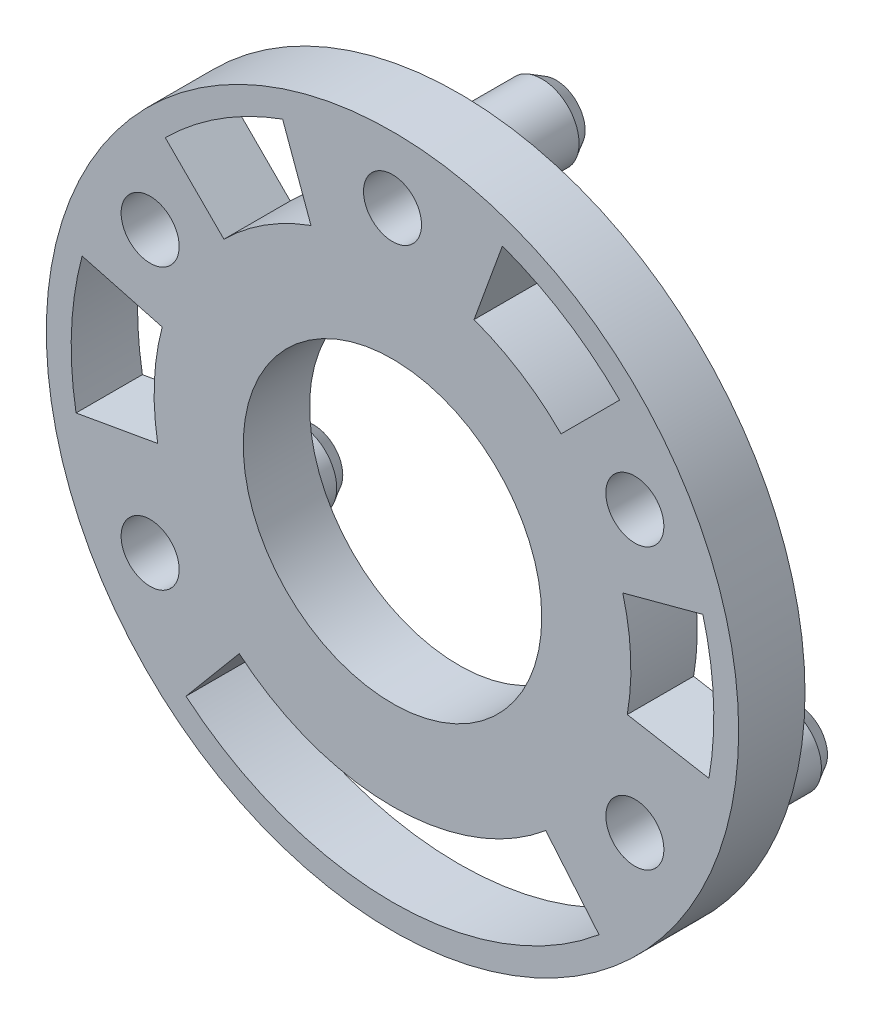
SolidWorks part; units mm, degrees
ref_plane "Front Plane" through (0, 0, 0) normal (0, 0, 1) x (1, 0, 0)
ref_plane "Top Plane" through (0, 0, 0) normal (0, 1, 0) x (1, 0, 0)
ref_plane "Right Plane" through (0, 0, 0) normal (1, 0, 0) x (0, 0, -1)
sketch "Sketch1" plane through (0, 0, 0) normal (0, 0, 1) x (1, 0, 0)
  line L0 (0, 0) -> (14.6142, -8.4375) construction
  line L1 (0, 0) -> (-14.6142, -8.4375) construction
  line L2 (0, -55) -> (0, 55) construction
  line L3 (-6.6266, 18.2065) -> (0, 0) construction
  line L4 (0, 0) -> (-19.0807, -3.3644) construction
  line L6 (-14.1566, -2.4962) -> (-19.0807, -3.3644)
  line L7 (-6.6266, 18.2065) -> (-4.9165, 13.5081)
  line L8 (19.0807, -3.3644) -> (14.1566, -2.4962)
  line L9 (4.9165, 13.5081) -> (6.6266, 18.2065)
  line L10 (-12.454, -14.8421) -> (-9.2401, -11.0119)
  line L11 (9.2401, -11.0119) -> (12.454, -14.8421)
  circle A0 centre (0, 0) radius 16.875 construction
  circle A1 centre (0, 16.875) radius 1.75
  circle A2 centre (-14.6142, -8.4375) radius 1.75
  circle A3 centre (14.6142, -8.4375) radius 1.75
  circle A4 centre (0, 0) radius 9
  circle A5 centre (0, 0) radius 20.875
  circle A6 centre (0, 0) radius 14.375 construction
  circle A7 centre (0, 0) radius 19.375 construction
  arc A8 (-14.1566, -2.4962) -> (-4.9165, 13.5081) centre (0, 0) cw
  arc A9 (-19.0807, -3.3644) -> (-6.6266, 18.2065) centre (0, 0) cw
  arc A10 (4.9165, 13.5081) -> (14.1566, -2.4962) centre (0, 0) cw
  arc A11 (6.6266, 18.2065) -> (19.0807, -3.3644) centre (0, 0) cw
  arc A12 (9.2401, -11.0119) -> (-9.2401, -11.0119) centre (0, 0) cw
  arc A13 (12.454, -14.8421) -> (-12.454, -14.8421) centre (0, 0) cw
  point P34 (0, 0)
  dimension "D1" = 33.75
  dimension "D4" = 3.5
  dimension "D5" = 18
  dimension "D6" = 4
  dimension "D7" = 2.5
  dimension "D8" = 2.5
  dimension "D2" = 120
  dimension "D3" = 120
  dimension "D9" = 20
  dimension "D10" = 20
  dimension "D11" = 3
extrude "Boss-Extrude1" add sketch "Sketch1" along normal blind 4
sketch "Sketch3" plane through (0, 0, 0) normal (0, 0, -1) x (-1, 0, 0)
  circle A0 centre (0, 16.875) radius 2.25
  circle A1 centre (-14.6142, -8.4375) radius 2.25
  circle A2 centre (14.6142, -8.4375) radius 2.25
  circle A3 centre (0, 16.875) radius 1.75
  circle A4 centre (-14.6142, -8.4375) radius 1.75
  circle A5 centre (14.6142, -8.4375) radius 1.75
  circle A6 centre (0, 16.875) radius 1.75 construction
  dimension "D1" = 4.5
extrude "Boss-Extrude2" add sketch "Sketch3" along normal blind 6 contours A0
sketch "Sketch5" plane through (0, 0, 4) normal (0, 0, 1) x (1, 0, 0)
  line L0 (-13.7002, 13.7002) -> (-10.1647, 10.1647)
  line L1 (-18.7148, 5.0146) -> (-13.8852, 3.7205)
  line L2 (0, 0) -> (-18.0783, 10.4375) construction
  line L3 (0, -55) -> (0, 55) construction
  line L4 (-13.7002, 13.7002) -> (0, 0) construction
  line L5 (-18.7148, 5.0146) -> (0, 0) construction
  arc A0 (-6.6266, 18.2065) -> (-19.0807, -3.3644) centre (0, 0) ccw construction
  arc A1 (-4.9165, 13.5081) -> (-14.1566, -2.4962) centre (0, 0) ccw construction
  circle A2 centre (0, 0) radius 16.875 construction
  arc A3 (-18.7148, 5.0146) -> (-13.7002, 13.7002) centre (0, 0) cw
  arc A4 (-13.8852, 3.7205) -> (-10.1647, 10.1647) centre (0, 0) cw
  arc A5 (-16.3, 4.3676) -> (-11.9324, 11.9324) centre (0, 0) cw construction
  circle A6 centre (-14.6142, 8.4375) radius 1.75
  circle A7 centre (0, 0) radius 20.875 construction
  point P13 (-11.9324, 11.9324)
  dimension "D1" = 3.5
  dimension "D2" = 60
  dimension "D3" = 30
extrude "Boss-Extrude4" add sketch "Sketch5" against normal up to surface (4 mm away)
mirror "Mirror1" about plane through (0, 0, 0) normal (1, 0, 0) of "Boss-Extrude4"
sketch "Sketch4" plane through (0, 0, 0) normal (0, 0, 1) x (1, 0, 0)
  line L0 (-14.7609, 14.7609) -> (14.7609, -14.7609) construction
  line L1 (55, 0) -> (-55, 0) construction
  line L2 (0, 0) -> (-17.1724, 11.8691) construction
  line L3 (0, 0) -> (-11.8691, 17.1724) construction
  line L4 (-17.1724, 11.8691) -> (-20.0642, 14.7609)
  line L5 (-11.8691, 17.1724) -> (-14.7609, 20.0642)
  line L6 (-20.0642, 14.7609) -> (-14.7609, 20.0642) construction
  line L7 (11.8691, -17.1724) -> (14.7609, -20.0642)
  line L8 (17.1724, -11.8691) -> (20.0642, -14.7609)
  circle A0 centre (0, 0) radius 20.875 construction
  circle A1 centre (0, 0) radius 20.875 construction
  arc A2 (-17.1724, 11.8691) -> (-11.8691, 17.1724) centre (0, 0) cw
  arc A3 (-20.0642, 14.7609) -> (-14.7609, 20.0642) centre (-17.4125, 17.4125) cw
  circle A4 centre (-17.4125, 17.4125) radius 1.75
  arc A5 (20.0642, -14.7609) -> (14.7609, -20.0642) centre (17.4125, -17.4125) cw
  arc A6 (17.1724, -11.8691) -> (11.8691, -17.1724) centre (0, 0) cw
  circle A7 centre (17.4125, -17.4125) radius 1.75
  point P25 (0, 0)
  dimension "D2" = 3.5
  dimension "D3" = 2
  dimension "D4" = 3.75
  dimension "D1" = 45
  dimension "D5" = 2
chamfer "Chamfer1" distance 1 angle 30 3 edges at (-16.8642, -8.4375, -6) (12.3642, -8.4375, -6) (-2.25, 16.875, -6)
